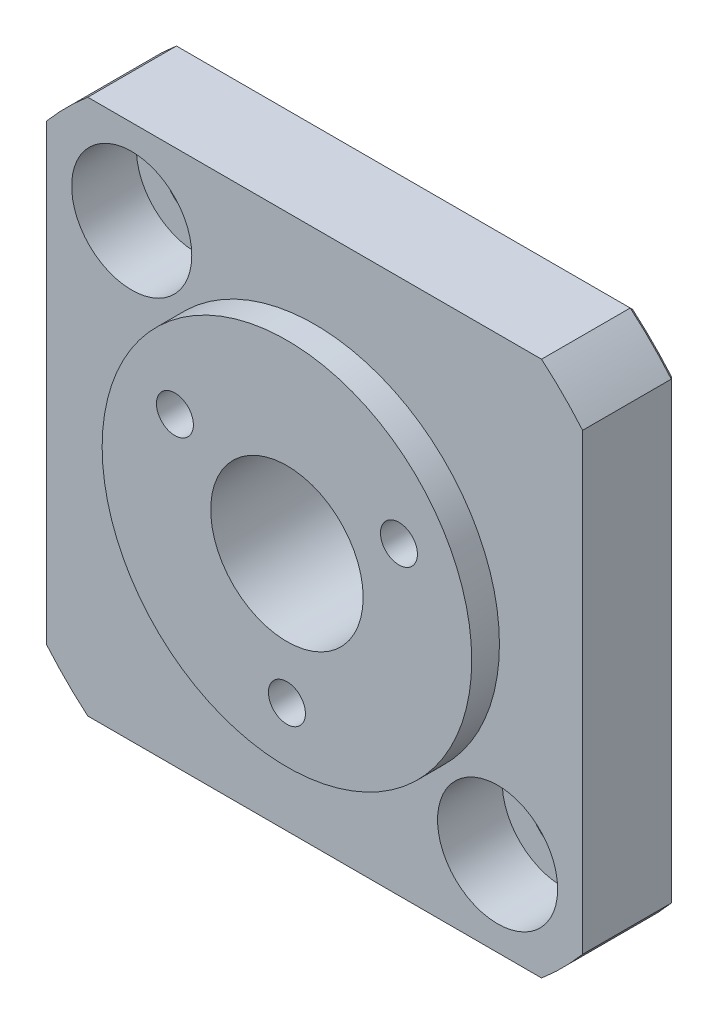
SolidWorks part; units mm, degrees
ref_plane "Front" through (0, 0, 0) normal (0, 0, 1) x (1, 0, 0)
ref_plane "Top" through (0, 0, 0) normal (0, 1, 0) x (1, 0, 0)
ref_plane "Right" through (0, 0, 0) normal (1, 0, 0) x (0, 0, -1)
sketch "Sketch1" plane through (0, 0, 0) normal (0, 0, 1) x (1, 0, 0)
  line L0 (0, 0) -> (14.5, 0) construction
  line L1 (-12.278, 14.5) -> (12.278, 14.5)
  line L2 (-14.5, 12.278) -> (-14.5, -12.278)
  line L3 (-12.278, -14.5) -> (12.278, -14.5)
  line L4 (14.5, 12.278) -> (14.5, -12.278)
  line L5 (0, 0) -> (0, 14.5) construction
  arc A0 (-12.278, 14.5) -> (-14.5, 12.278) centre (0, 0) ccw
  arc A1 (14.5, 12.278) -> (12.278, 14.5) centre (0, 0) ccw
  arc A2 (12.278, -14.5) -> (14.5, -12.278) centre (0, 0) ccw
  arc A3 (-14.5, -12.278) -> (-12.278, -14.5) centre (0, 0) ccw
  dimension "D1" = 29
  dimension "D3" = 19
  dimension "D2" = 29
extrude "Base-Extrude" add sketch "Sketch1" along normal blind 5
sketch "Sketch2" plane through (0, 0, 5) normal (0, 0, 1) x (1, 0, 0)
  line L0 (9.9, -9.9) -> (-9.9, 9.9) construction
  circle A0 centre (-9.9, 9.9) radius 1.75
  circle A1 centre (9.9, -9.9) radius 1.75
  dimension "D1" = 3.5
  dimension "D2" = 19.8
  dimension "D3" = 19.8
extrude "Thru Holes" cut sketch "Sketch2" against normal through all
sketch "Sketch3" plane through (0, 0, 5) normal (0, 0, 1) x (1, 0, 0)
  circle A0 centre (0, 0) radius 10
  dimension "D1" = 20
extrude "Nose" add sketch "Sketch3" along normal blind 1.5
sketch "Sketch4" plane through (0, 0, 6.5) normal (0, 0, 1) x (1, 0, 0)
  circle A0 centre (0, 0) radius 4.125
  dimension "D1" = 8.25
extrude "Bore" cut sketch "Sketch4" against normal through all
chamfer "Chamfer1" distance 0.2 angle 45 8 edges at (14.5, 0, 0) (13.435, -13.435, 0) (0, -14.5, 0) (-13.435, -13.435, 0) (-14.5, 0, 0) (-13.435, 13.435, 0) (0, 14.5, 0) (13.435, 13.435, 0)
sketch "Sketch5" plane through (0, 0, 5) normal (0, 0, 1) x (1, 0, 0)
  circle A0 centre (-9.9, 9.9) radius 3.25
  circle A1 centre (9.9, -9.9) radius 3.25
  dimension "D1" = 6.5
extrude "Cbore" cut sketch "Sketch5" against normal blind 3.5
hole_wizard "M2.0 (2.000000) Diameter Hole1" positions "Sketch7" profile "Sketch6" hole size "M2.0" standard "Ansi Metric"
sketch "Sketch7" plane through (0, 0, 6.5) normal (0, 0, 1) x (1, 0, 0)
  line L0 (0, 0) -> (6.0622, 3.5) construction
  line L1 (0, 0) -> (7, 0) construction
  circle A0 centre (0, 0) radius 7 construction
  point P0 (6.0622, 3.5)
  dimension "D1" = 14
  dimension "D2" = 30
sketch "Sketch6" plane through (6.0622, 3.5, 6.5) normal (1, 0, 0) x (0, -1, 0)
  line L0 (0, 0) -> (0, 2.1009)
  line L1 (0, 2.1009) -> (1, 1.5)
  line L2 (1, 1.5) -> (1, 0)
  line L5 (1, 0) -> (0, 0)
  line L10 (0, 2.1009) -> (-1, 1.5) construction
  line L11 (0, -6.35) -> (0, 107.95) construction
  dimension "Hole Dia." = 2
  dimension "Hole Depth" = 1.5
  dimension "Drill Angle" = 118
pattern_circular "CirPattern1" count 3 over 360 about axis through (0, 0, 0) along (0, 0, 1) of "M2.0 (2.000000) Diameter Hole1"
